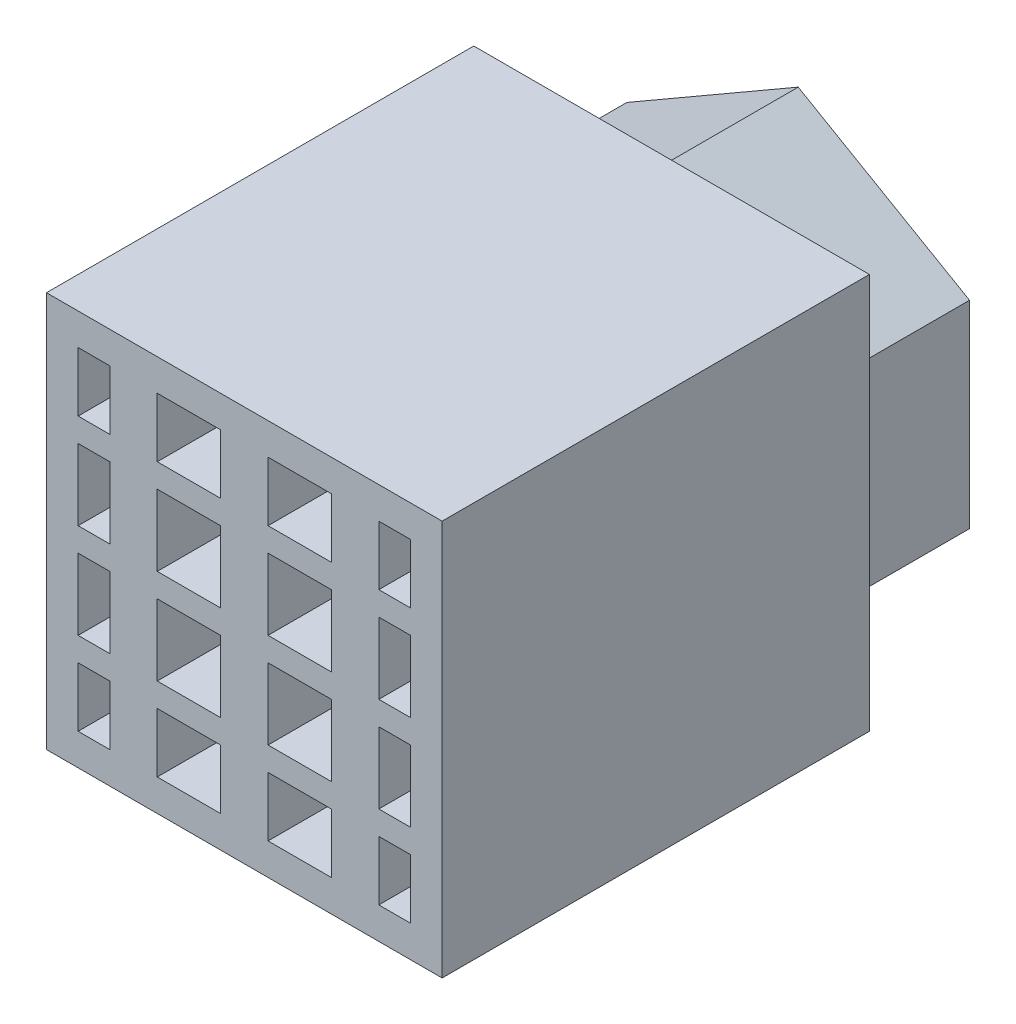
SolidWorks part; units mm, degrees
ref_plane "前视基准面" through (0, 0, 0) normal (0, 0, 1) x (1, 0, 0)
ref_plane "上视基准面" through (0, 0, 0) normal (0, 1, 0) x (1, 0, 0)
ref_plane "右视基准面" through (0, 0, 0) normal (1, 0, 0) x (0, 0, -1)
sketch "草图8" plane through (0, 0, 0) normal (0, 0, 1) x (1, 0, 0)
  line L0 (0, 7.8741) -> (0, -9.2542) construction
  line L1 (-12.5, -12.5) -> (12.5, -12.5)
  line L2 (-12.5, -12.5) -> (-12.5, 12.5)
  line L3 (-12.5, 12.5) -> (12.5, 12.5)
  line L4 (12.5, -12.5) -> (12.5, 12.5)
  line L5 (-12.5, -12.5) -> (12.5, 12.5) construction
  line L6 (-12.5, 12.5) -> (12.5, -12.5) construction
  line L7 (-16.0619, 0) -> (15.5648, 0) construction
  line L8 (-3.5, 7.8741) -> (-3.5, -9.2542) construction
  line L9 (-9.5, 7.8741) -> (-9.5, -9.2542) construction
  line L10 (5.5, 10.5) -> (1.5, 10.5)
  line L15 (-5.5, -10.5) -> (-1.5, -10.5)
  line L20 (-5.5, -10.5) -> (-5.5, 10.5)
  line L21 (-5.5, 10.5) -> (-1.5, 10.5)
  line L26 (-1.5, -10.5) -> (-1.5, 10.5)
  line L27 (-5.5, -10.5) -> (-1.5, 10.5) construction
  line L28 (-5.5, 10.5) -> (-1.5, -10.5) construction
  line L29 (-10.5, -10.5) -> (-8.5, -10.5)
  line L30 (-10.5, -10.5) -> (-10.5, 10.5)
  line L31 (-10.5, 10.5) -> (-8.5, 10.5)
  line L32 (-8.5, -10.5) -> (-8.5, 10.5)
  line L33 (-10.5, -10.5) -> (-8.5, 10.5) construction
  line L34 (-10.5, 10.5) -> (-8.5, -10.5) construction
  line L35 (1.5, -10.5) -> (1.5, 10.5)
  line L36 (5.5, -10.5) -> (1.5, -10.5)
  line L37 (5.5, -10.5) -> (5.5, 10.5)
  line L38 (10.5, 10.5) -> (8.5, 10.5)
  line L39 (8.5, -10.5) -> (8.5, 10.5)
  line L40 (10.5, -10.5) -> (8.5, -10.5)
  line L41 (10.5, -10.5) -> (10.5, 10.5)
  point P0 (0, 0)
  point P14 (-7, 0)
  point P15 (-3.5, 0)
  point P17 (-3, 0)
  point P21 (-9.5, 0)
  point P22 (-9, 0)
  dimension "D1" = 3.5
  dimension "D2" = 6
extrude "凸台-拉伸7" add sketch "草图8" along normal blind 25
sketch "草图9" plane through (0, 0, 0) normal (0, 0, -1) x (-1, 0, 0)
  line L1 (-12.5, -12.5) -> (12.5, -12.5)
  line L2 (-12.5, -12.5) -> (-12.5, 12.5)
  line L3 (-12.5, 12.5) -> (12.5, 12.5)
  line L4 (12.5, -12.5) -> (12.5, 12.5)
  line L5 (-12.5, -12.5) -> (12.5, 12.5) construction
  line L6 (-12.5, 12.5) -> (12.5, -12.5) construction
  point P0 (0, 0)
extrude "凸台-拉伸8" add sketch "草图9" along normal blind 2
sketch "草图14" plane through (0, 0, 25) normal (0, 0, 1) x (1, 0, 0)
  line L0 (-16.6961, 0) -> (20.7273, 0) construction
  line L1 (-12.5, 12.5) -> (-12.5, -12.5) construction
  line L2 (12.5, -0.75) -> (-12.5, -0.75)
  line L3 (12.5, -0.75) -> (12.5, 0.75)
  line L4 (12.5, 0.75) -> (-12.5, 0.75)
  line L5 (-12.5, -0.75) -> (-12.5, 0.75)
  line L6 (12.5, -0.75) -> (-12.5, 0.75) construction
  line L7 (12.5, 0.75) -> (-12.5, -0.75) construction
  line L12 (12.5, 5.25) -> (-12.5, 5.25)
  line L13 (12.5, 5.25) -> (12.5, 6.75)
  line L14 (12.5, 6.75) -> (-12.5, 6.75)
  line L15 (-12.5, 5.25) -> (-12.5, 6.75)
  line L16 (12.5, 5.25) -> (-12.5, 6.75) construction
  line L17 (12.5, 6.75) -> (-12.5, 5.25) construction
  line L18 (12.5, -6.75) -> (-12.5, -5.25) construction
  line L19 (12.5, -5.25) -> (-12.5, -6.75) construction
  line L20 (-12.5, -5.25) -> (-12.5, -6.75)
  line L21 (12.5, -6.75) -> (-12.5, -6.75)
  line L22 (12.5, -5.25) -> (12.5, -6.75)
  line L23 (12.5, -5.25) -> (-12.5, -5.25)
  point P3 (0, 0)
  point P11 (0, 6)
  point P19 (0, -6)
  dimension "D1" = 2
extrude "凸台-拉伸11" add sketch "草图14" against normal blind 25
sketch "草图16" plane through (0, 0, -2) normal (0, 0, -1) x (-1, 0, 0)
  line L0 (0, -10.1906) -> (8.8253, -5.0953)
  line L1 (0, -12.5) -> (10.8253, -6.25)
  line L2 (10.8253, -6.25) -> (10.8253, 6.25)
  line L3 (10.8253, 6.25) -> (0, 12.5)
  line L4 (0, 12.5) -> (-10.8253, 6.25)
  line L5 (-10.8253, 6.25) -> (-10.8253, -6.25)
  line L6 (-10.8253, -6.25) -> (0, -12.5)
  line L7 (8.8253, -5.0953) -> (8.8253, 5.0953)
  line L8 (8.8253, 5.0953) -> (0, 10.1906)
  line L9 (0, 10.1906) -> (-8.8253, 5.0953)
  line L10 (-8.8253, 5.0953) -> (-8.8253, -5.0953)
  line L11 (-8.8253, -5.0953) -> (0, -10.1906)
  circle A0 centre (0, 0) radius 12.5 construction
  dimension "D1" = 2
extrude "凸台-拉伸14" add sketch "草图16" along normal blind 6
sketch "草图18" plane through (0, 0, -8) normal (0, 0, -1) x (-1, 0, 0)
  line L1 (0, 12.5) -> (-10.8253, 6.25)
  line L2 (-10.8253, 6.25) -> (-10.8253, -6.25)
  line L3 (-10.8253, -6.25) -> (0, -12.5)
  line L4 (0, -12.5) -> (10.8253, -6.25)
  line L5 (10.8253, -6.25) -> (10.8253, 6.25)
  line L6 (10.8253, 6.25) -> (0, 12.5)
  circle A0 centre (0, 0) radius 10.8253 construction
extrude "凸台-拉伸16" add sketch "草图18" along normal blind 2
